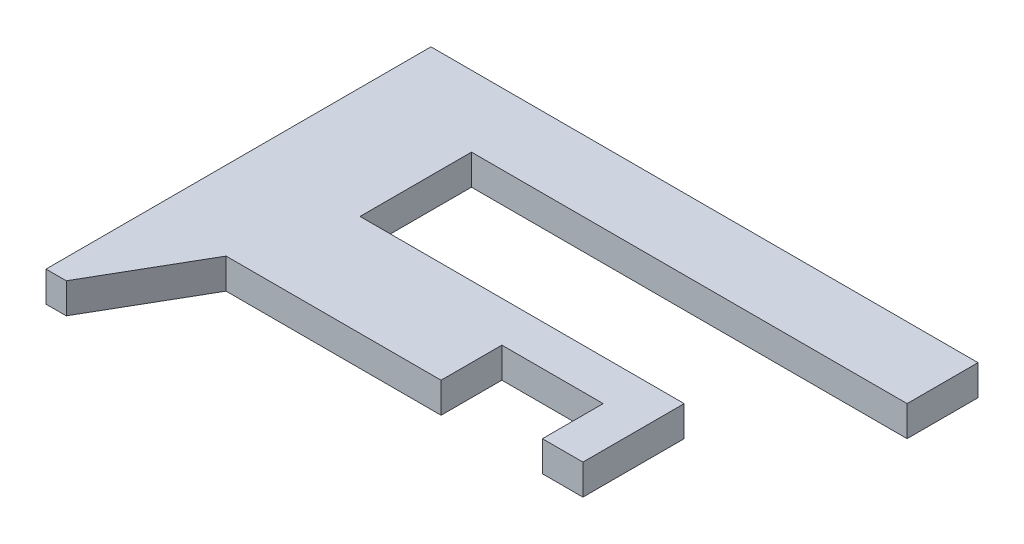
SolidWorks part; units mm, degrees
ref_plane "Front Plane" through (0, 0, 0) normal (0, 0, 1) x (1, 0, 0)
ref_plane "Top Plane" through (0, 0, 0) normal (0, 1, 0) x (1, 0, 0)
ref_plane "Right Plane" through (0, 0, 0) normal (1, 0, 0) x (0, 0, -1)
sketch "Sketch1" plane through (0, 0, 0) normal (0, 1, 0) x (1, 0, 0)
  line L0 (0, 0) -> (2, 0)
  line L1 (2, 0) -> (7.7735, 10)
  line L2 (7.7735, 10) -> (29, 10)
  line L3 (29, 10) -> (29, 16)
  line L4 (29, 16) -> (39, 16)
  line L5 (39, 16) -> (39, 10)
  line L6 (39, 10) -> (43, 10)
  line L7 (43, 10) -> (43, 20)
  line L8 (43, 20) -> (11, 20)
  line L9 (11, 20) -> (11, 31)
  line L10 (11, 31) -> (54, 31)
  line L11 (54, 31) -> (54, 38)
  line L12 (54, 38) -> (0, 38)
  line L13 (0, 38) -> (0, 0)
  dimension "D1" = 2
  dimension "D2" = 60
  dimension "D3" = 27
  dimension "D4" = 10
  dimension "D5" = 4
  dimension "D6" = 7
  dimension "D7" = 11
  dimension "D8" = 4
  dimension "D9" = 6
  dimension "D10" = 11
  dimension "D11" = 43
  dimension "D12" = 38
extrude "Extrude1" add sketch "Sketch1" along normal blind 3
